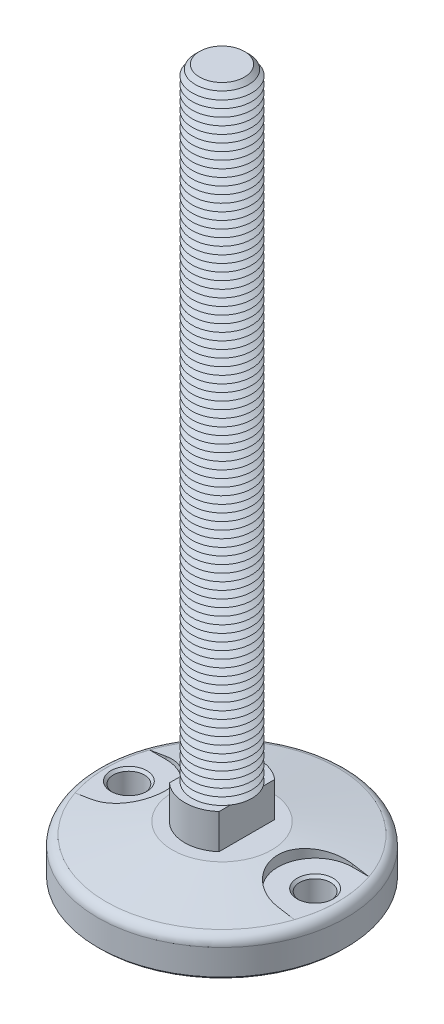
SolidWorks part; units mm, degrees
ref_plane "Front Plane" through (0, 0, 0) normal (0, 0, 1) x (1, 0, 0)
ref_plane "Top Plane" through (0, 0, 0) normal (0, 1, 0) x (1, 0, 0)
ref_plane "Right Plane" through (0, 0, 0) normal (1, 0, 0) x (0, 0, -1)
sketch "Sketch1" plane through (0, 0, 0) normal (1, 0, 0) x (0, 0, -1)
  line L0 (0, 61.3389) -> (0, -58.404) construction
sketch "Sketch2" plane through (0, 0, 0) normal (1, 0, 0) x (0, 0, -1)
  line L0 (0, 0) -> (-20, 0)
  line L1 (-20, 0) -> (-50, -5.2898)
  line L2 (-50, -5.2898) -> (-50, -20)
  line L3 (-50, -20) -> (0, -20)
  line L4 (0, 61.3389) -> (0, -58.404) construction
  line L5 (0, -20) -> (0, 0)
  dimension "D1" = 20
  dimension "D2" = 50
  dimension "D3" = 20
  dimension "D4" = 10
revolve "Revolve1" add sketch "Sketch2" angle 360 about L0
fillet "Fillet1" radius 4 1 edges at (0, -5.2898, 50)
sketch "Sketch3" plane through (0, 0, 0) normal (0, 1, 0) x (1, 0, 0)
  circle A0 centre (0, 0) radius 15
  dimension "D1" = 30
extrude "Boss-Extrude1" add sketch "Sketch3" along normal blind 14
sketch "Sketch4" plane through (0, 14, 0) normal (0, 1, 0) x (1, 0, 0)
  line L0 (-10, 11.1803) -> (-10, -11.1803)
  line L2 (10, -11.1803) -> (10, 11.1803)
  arc A0 (-10, 11.1803) -> (-10, -11.1803) centre (0, 0) ccw
  circle A1 centre (0, 0) radius 15 construction
  arc A2 (10, -11.1803) -> (10, 11.1803) centre (0, 0) ccw
  dimension "D1" = 20
extrude "Cut-Extrude1" cut sketch "Sketch4" against normal blind 14
sketch "Sketch5" plane through (0, 14, 0) normal (0, 1, 0) x (1, 0, 0)
  circle A0 centre (0, 0) radius 12
  dimension "D1" = 24
extrude "Boss-Extrude2" add sketch "Sketch5" along normal blind 250
chamfer "Chamfer1" distance 3 angle 45 1 edges at (0, 264, 12)
sketch "Sketch6" plane through (0, 0, 0) normal (1, 0, 0) x (0, 0, -1)
  line L0 (-12, 14) -> (-9.4019, 15.5)
  line L1 (-9.4019, 15.5) -> (-12, 17)
  line L2 (-12, 261) -> (-12, 14) construction
  line L3 (-12, 17) -> (-12, 14)
  dimension "D1" = 3
revolve "Cut-Revolve1" cut sketch "Sketch6" angle 360 about L0
pattern_linear "LPattern1" count 83 spacing 3 along (0, 1, 0) of "Cut-Revolve1"
sketch "Sketch8" plane through (0, 0, 0) normal (0, 1, 0) x (1, 0, 0)
  line L0 (-37.5, 15) -> (-44.2197, 15)
  line L1 (-37.5, -15) -> (-44.2197, -15)
  arc A1 (-44.2197, 15) -> (-44.2197, -15) centre (0, 0) ccw
  circle A2 centre (0, 0) radius 46.6946 construction
  arc A3 (-37.5, -15) -> (-37.5, 15) centre (-37.5, 0) ccw
  point P3 (-37.5, 0)
  point P11 (0, 0)
  dimension "D1" = 37.5
  dimension "D2" = 30
extrude "Cut-Extrude4" cut sketch "Sketch8" against normal blind 4.7
sketch "Sketch10" plane through (0, -4.7, 0) normal (0, 1, 0) x (1, 0, 0)
  circle A0 centre (-37.5, 0) radius 6.25
  dimension "D1" = 12.5
extrude "Cut-Extrude5" cut sketch "Sketch10" against normal up to surface (15.3 mm away)
chamfer "Chamfer2" distance 1 angle 45 2 edges at (-37.5, -20, -6.25) (-37.5, -4.7, 6.25)
mirror "Mirror1" about plane through (0, 0, 0) normal (1, 0, 0) of "Chamfer2", "Cut-Extrude5", "Cut-Extrude4"
chamfer "Chamfer3" distance 1 angle 45 1 edges at (0, -20, 50)
